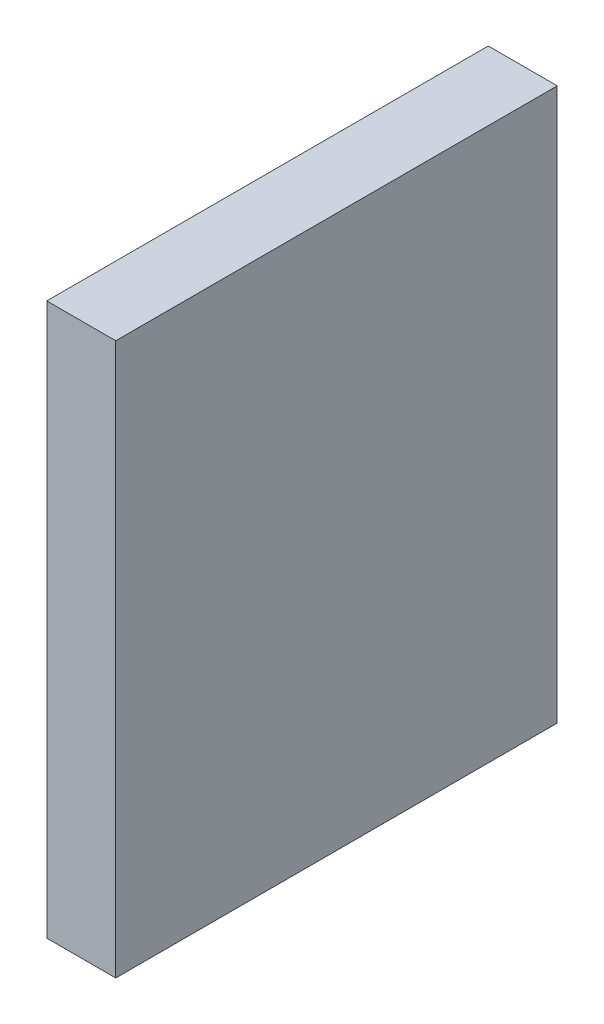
SolidWorks part; units mm, degrees
ref_plane "Спереди" through (0, 0, 0) normal (0, 0, 1) x (1, 0, 0)
ref_plane "Сверху" through (0, 0, 0) normal (0, 1, 0) x (1, 0, 0)
ref_plane "Справа" through (0, 0, 0) normal (1, 0, 0) x (0, 0, -1)
sketch "Эскиз1" plane through (0, 0, 0) normal (1, 0, 0) x (0, 0, -1)
  line L1 (0, 0) -> (64, 0)
  line L2 (0, 0) -> (0, 80)
  line L3 (0, 80) -> (64, 80)
  line L4 (64, 0) -> (64, 80)
extrude "Бобышка-Вытянуть1" add sketch "Эскиз1" along normal blind 10
